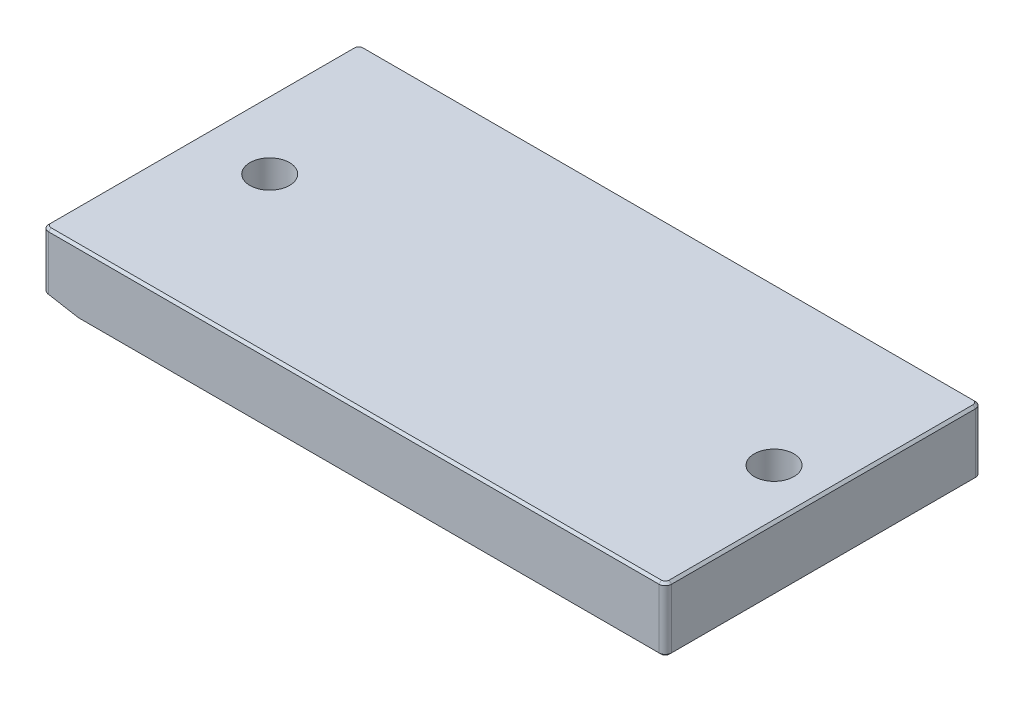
SolidWorks part; units mm, degrees
ref_plane "Front Plane" through (0, 0, 0) normal (0, 0, 1) x (1, 0, 0)
ref_plane "Top Plane" through (0, 0, 0) normal (0, 1, 0) x (1, 0, 0)
ref_plane "Right Plane" through (0, 0, 0) normal (1, 0, 0) x (0, 0, -1)
sketch "Sketch1" plane through (0, 0, 0) normal (0, 1, 0) x (1, 0, 0)
  line L1 (-98.425, 50.8) -> (101.6, 50.8)
  line L2 (-98.425, 50.8) -> (-98.425, -50.8)
  line L3 (-98.425, -50.8) -> (101.6, -50.8)
  line L4 (101.6, 50.8) -> (101.6, -50.8)
  dimension "D1" = 101.6
  dimension "D2" = 200.025
  dimension "D3" = 98.425
  dimension "D4" = 50.8
extrude "Boss-Extrude1" add sketch "Sketch1" along normal blind 20.6248
hole_wizard "CBORE for 1/4 Socket Head Cap Screw2" positions "Sketch2" profile "Sketch3" counterbore size "1/4" standard "ANSI Inch"
sketch "Sketch2" plane through (0, 0, 0) normal (0, -1, 0) x (-1, 0, 0)
  point P0 (76.2, 0)
  point P2 (-85.725, 0)
  dimension "D1" = 76.2
  dimension "D2" = 85.725
sketch "Sketch3" plane through (-76.2, 0, 0) normal (1, 0, 0) x (0, 0, -1)
  line L0 (0, 0) -> (0, 20.6248)
  line L1 (0, 20.6248) -> (6.3627, 20.6248)
  line L3 (6.3627, 20.6248) -> (6.3627, 8.3312)
  line L4 (6.3627, 8.3312) -> (10.3124, 8.3312)
  line L5 (10.3124, 8.3312) -> (10.3124, 0)
  line L7 (10.3124, 0) -> (0, 0)
  line L11 (0, -6.35) -> (0, 107.95) construction
  dimension "Thru Hole Dia." = 12.7254
  dimension "Thru Hole Depth" = 20.6248
  dimension "C'Bore Dia." = 20.6248
  dimension "C'Bore Depth" = 8.3312
chamfer "Chamfer1" distance 9.652 angle 10 1 edges at (-98.425, 0, 0)
fillet "Fillet1" radius 2.032 4 edges at (-98.425, 11.1634, -50.8) (101.6, 10.3124, -50.8) (101.6, 10.3124, 50.8) (-98.425, 11.1634, 50.8)
chamfer "Chamfer2" distance 0.762 angle 45 18 edges at (-98.425, 20.6248, 0) (1.5875, 20.6248, 50.8) (101.6, 20.6248, 0) (101.6, 0, 0) (5.3975, 0, 50.8) (-92.583, 0.6718, -50.8) (-92.583, 0.6718, 50.8) (-97.8298, 1.597, -50.2048) (-97.8298, 1.597, 50.2048) (-98.425, 1.7019, 0) (101.0048, 0, 50.2048) (101.0048, 0, -50.2048) (5.3975, 0, -50.8) (101.0048, 20.6248, 50.2048) (-97.8298, 20.6248, 50.2048) (101.0048, 20.6248, -50.2048) (-97.8298, 20.6248, -50.2048) (1.5875, 20.6248, -50.8)
sketch "Sketch4" plane through (0, 0, -50.8) normal (0, 0, -1) x (-1, 0, 0)
  text T0 "0" font "Century Gothic" height in points 18
extrude "Cut-Extrude1" cut sketch "Sketch4" against normal blind 0.0508
